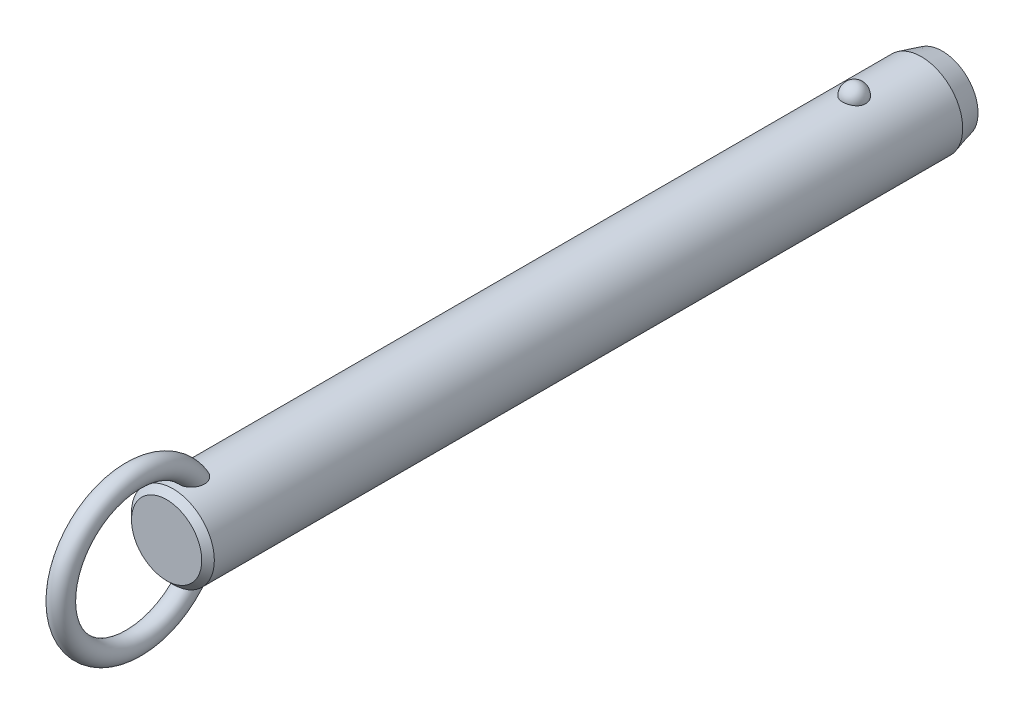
SolidWorks part; units mm, degrees
ref_plane "Front Plane" through (0, 0, 0) normal (0, 0, 1) x (1, 0, 0)
ref_plane "Top Plane" through (0, 0, 0) normal (0, 1, 0) x (1, 0, 0)
ref_plane "Right Plane" through (0, 0, 0) normal (1, 0, 0) x (0, 0, -1)
sketch "Sketch2" plane through (0, 0, 0) normal (0, 0, 1) x (1, 0, 0)
  circle A0 centre (0, 0) radius 7.9
  point P3 (0, 7.9)
  dimension "D1" = 15.8
extrude "Boss-Extrude1" add sketch "Sketch2" along normal blind 119.4
sketch "Sketch3" plane through (0, 0, 0) normal (0, 0, -1) x (-1, 0, 0)
  circle A0 centre (0, 0) radius 7.9
  dimension "D1" = 15.8
extrude "Boss-Extrude2" add sketch "Sketch3" along normal blind 19
chamfer "Chamfer1" distance 4 angle 15 1 edges at (-7.9, 0, -19)
sketch "Sketch12" plane through (0, 0, 0) normal (1, 0, 0) x (0, 0, -1)
  line L0 (-119.4, 7.9) -> (-119.4, -7.9) construction
  point P0 (-119.4, 0)
sketch "Sketch13" plane through (0, 0, 0) normal (1, 0, 0) x (0, 0, -1)
  circle A0 centre (-135.25, 0) radius 15.85
  point P2 (-119.4, 0)
  dimension "D1" = 31.7
sketch "Sketch14" plane through (0, 0, 0) normal (0, 1, 0) x (1, 0, 0)
  circle A0 centre (0, -121.4) radius 2
  point P2 (0, -119.4)
  dimension "D1" = 4
sweep "Sweep1" add profiles "Sketch14" path "Sketch13"
sketch "Sketch15" plane through (0, 0, 119.4) normal (0, 0, 1) x (1, 0, 0)
  circle A0 centre (0, 0) radius 7.9
  dimension "D1" = 15.8
extrude "Boss-Extrude3" add sketch "Sketch15" along normal blind 9.52
chamfer "Chamfer2" distance 1.2 angle 45 1 edges at (7.9, 0, 128.92)
sketch "Sketch18" plane through (0, 0, 0) normal (1, 0, 0) x (0, 0, -1)
  line L0 (15, 7.9) -> (-121.5091, 7.9) construction
  line L1 (2.2, 10.1) -> (2.2, 5.7)
  line L2 (-121.5091, -7.9) -> (15, -7.9) construction
  arc A0 (2.2, 10.1) -> (2.2, 5.7) centre (2.2, 7.9) ccw
  point P4 (0, 7.9)
  dimension "D1" = 18
revolve "Revolve1" add sketch "Sketch18" angle 360 about L1
